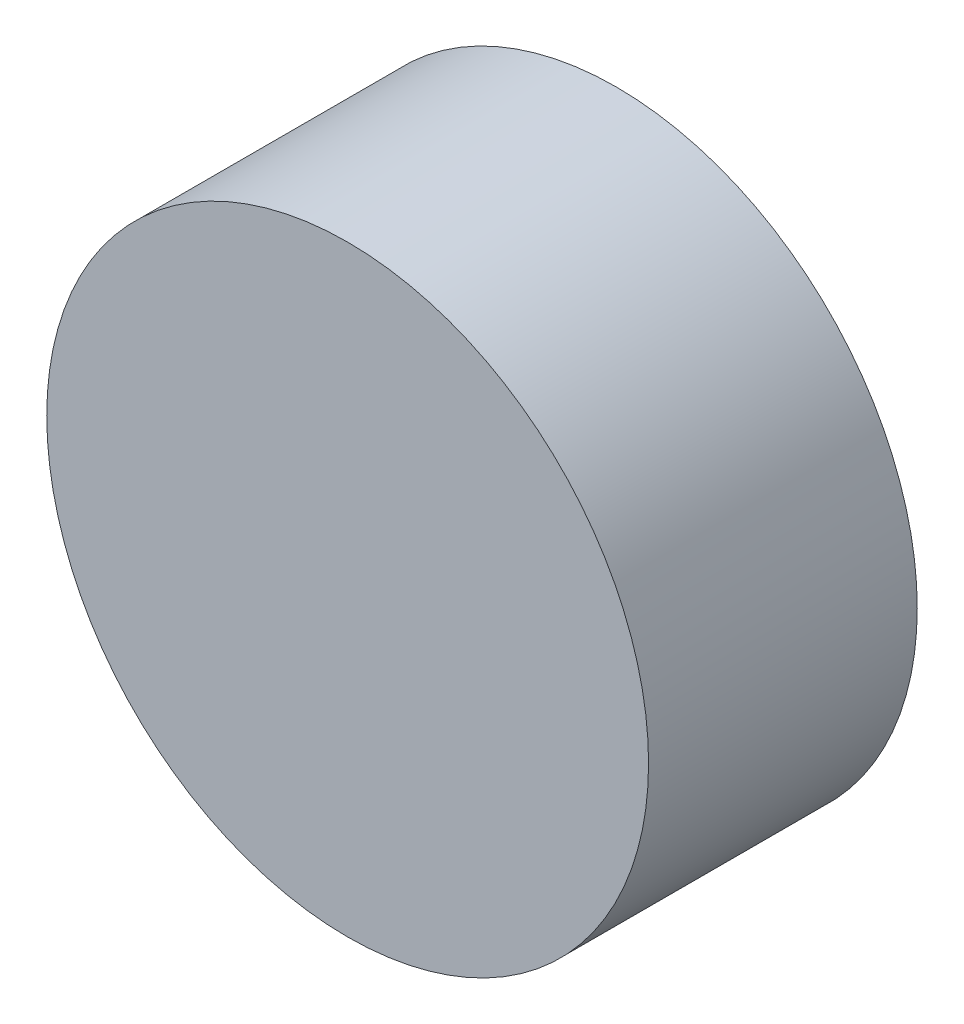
SolidWorks part; units mm, degrees
ref_plane "Front Plane" through (0, 0, 0) normal (0, 0, 1) x (1, 0, 0)
ref_plane "Top Plane" through (0, 0, 0) normal (0, 1, 0) x (1, 0, 0)
ref_plane "Right Plane" through (0, 0, 0) normal (1, 0, 0) x (0, 0, -1)
sketch "Sketch1" plane through (0, 0, 0) normal (0, 0, 1) x (1, 0, 0)
  circle A0 centre (0, 0) radius 28
  dimension "D1" = 56
extrude "Boss-Extrude1" add sketch "Sketch1" along normal mid plane 25
